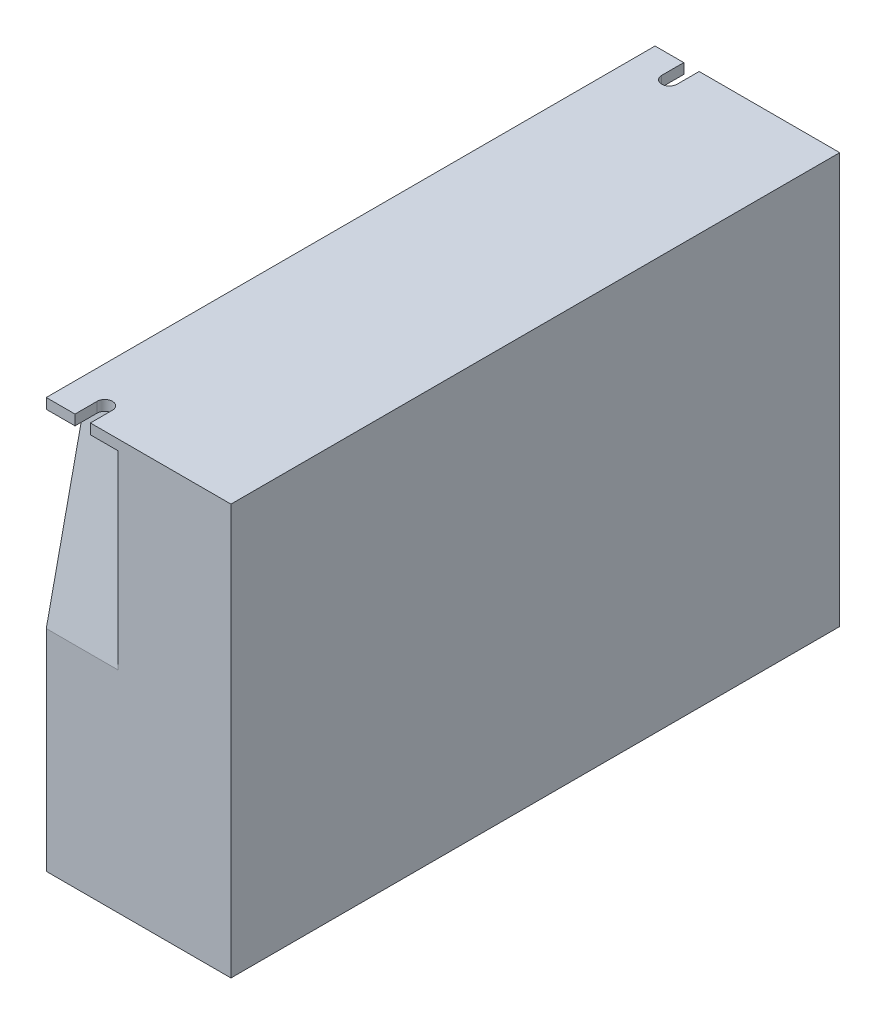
SolidWorks part; units mm, degrees
ref_plane "前视基准面" through (0, 0, 0) normal (0, 0, 1) x (1, 0, 0)
ref_plane "上视基准面" through (0, 0, 0) normal (0, 1, 0) x (1, 0, 0)
ref_plane "右视基准面" through (0, 0, 0) normal (1, 0, 0) x (0, 0, -1)
sketch "草图1" plane through (0, 0, 0) normal (1, 0, 0) x (0, 0, -1)
  line L1 (-89, -60) -> (89, -60)
  line L2 (-89, -60) -> (-89, 60)
  line L3 (-89, 60) -> (89, 60)
  line L4 (89, -60) -> (89, 60)
  line L5 (-89, -60) -> (89, 60) construction
  line L6 (-89, 60) -> (89, -60) construction
  point P0 (0, 0)
extrude "凸台-拉伸1" add sketch "草图1" along normal blind 54
sketch "草图2" plane through (0, 0, 0) normal (-1, 0, 0) x (0, 0, 1)
  line L1 (-89, -60) -> (-89, 60) construction
  line L2 (-89, 57) -> (-77, 57)
  line L3 (-89, 57) -> (-89, 1.5)
  line L4 (-77, 57) -> (-89, 1.5)
  line L5 (89, 57) -> (89, 1.5)
  line L6 (89, 60) -> (89, -60) construction
  line L7 (89, 57) -> (77, 57)
  line L8 (77, 57) -> (89, 1.5)
extrude "切除-拉伸1" cut sketch "草图2" against normal blind 21
sketch "草图3" plane through (0, 60, 0) normal (0, 1, 0) x (1, 0, 0)
  line L1 (54, 89) -> (0, 89) construction
  line L3 (8.4, 82.55) -> (8.4, 89)
  line L4 (8.4, 89) -> (12.9, 89)
  line L5 (12.9, 89) -> (12.9, 82.55)
  line L6 (8.4, -82.55) -> (8.4, -89)
  line L7 (54, -89) -> (0, -89) construction
  line L9 (8.4, -89) -> (12.9, -89)
  line L10 (12.9, -89) -> (12.9, -82.55)
  arc A0 (8.4, 82.55) -> (12.9, 82.55) centre (10.65, 82.55) ccw
  arc A1 (12.9, -82.55) -> (8.4, -82.55) centre (10.65, -82.55) ccw
extrude "切除-拉伸2" cut sketch "草图3" against normal blind 3
sketch "草图4" plane through (54, 0, 0) normal (1, 0, 0) x (0, 0, -1)
  text T0 "MA-8" font "汉仪长仿宋体" height 12
